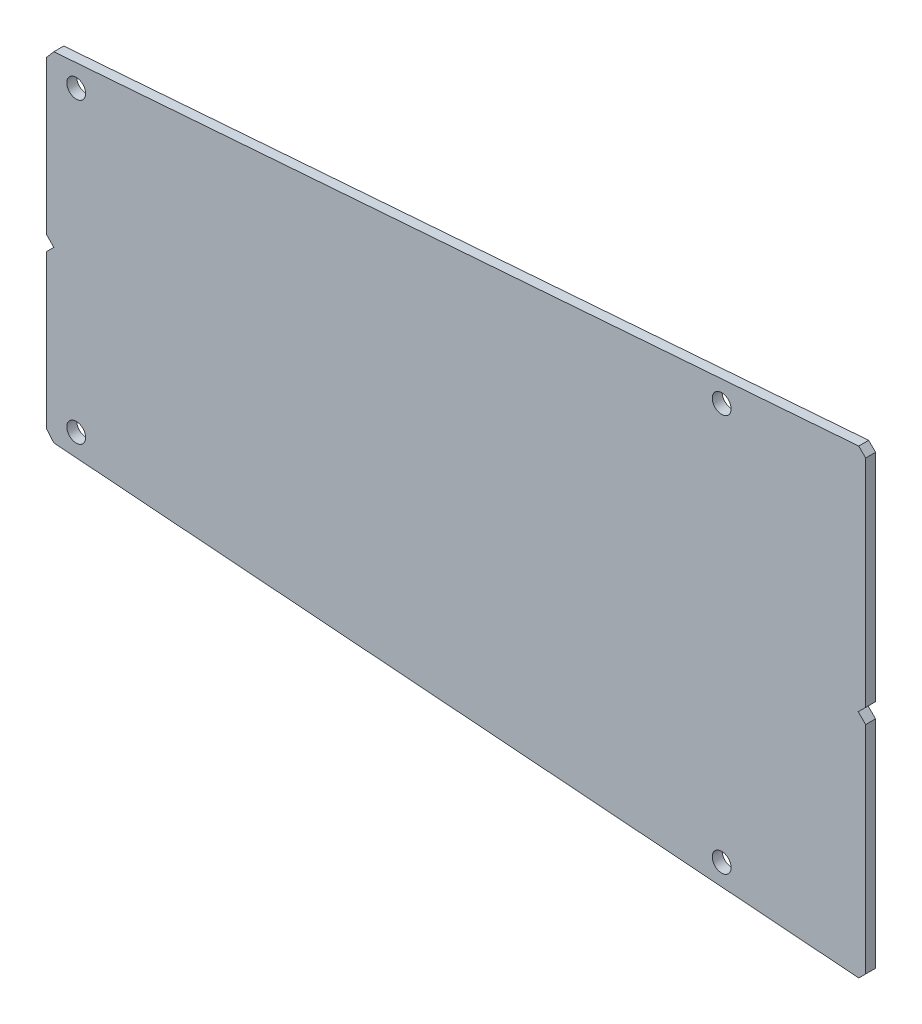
SolidWorks part; units mm, degrees
ref_plane "Plan de face" through (0, 0, 0) normal (0, 0, 1) x (1, 0, 0)
ref_plane "Plan de dessus" through (0, 0, 0) normal (0, 1, 0) x (1, 0, 0)
ref_plane "Plan de droite" through (0, 0, 0) normal (1, 0, 0) x (0, 0, -1)
sketch "Esquisse1" plane through (0, 0, 0) normal (0, 0, 1) x (1, 0, 0)
  line L0 (-49.4389, 0) -> (115.5611, 0)
  line L1 (115.5611, 0) -> (115.5611, 46.5)
  line L2 (115.5611, 46.5) -> (-49.4389, 34)
  line L3 (-49.4389, 34) -> (-49.4389, 0)
  circle A0 centre (86.5611, 40) radius 1.9
  circle A1 centre (-43.4389, 30) radius 1.9
  dimension "D4" = 6
  dimension "D1" = 165
  dimension "D2" = 34
  dimension "D3" = 46.5
  dimension "D5" = 4
  dimension "D6" = 130
  dimension "D7" = 6.5
extrude "Extrusion1" add sketch "Esquisse1" along normal blind 2
chamfer "Chanfrein1" distance 1.5 angle 45 1 edges at (115.5611, 46.5, 1)
chamfer "Chanfrein2" distance 1.5 angle 45 1 edges at (115.5611, 0, 1)
chamfer "Chanfrein3" distance 1.5 angle 45 1 edges at (-49.4389, 0, 1)
chamfer "Chanfrein4" distance 1.5 angle 45 1 edges at (-49.4389, 34, 1)
mirror "Symétrie1" about plane through (-49.4389, 0, 2) normal (0, 1, 0)
